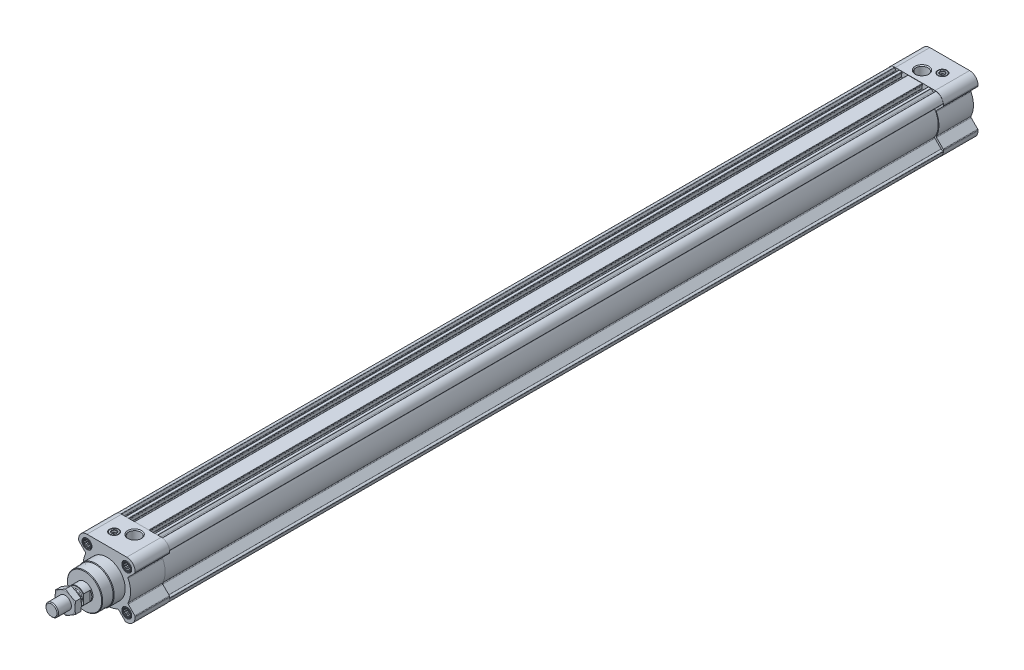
SolidWorks part; units mm, degrees
ref_plane "Plano frontal" through (0, 0, 0) normal (0, 0, 1) x (1, 0, 0)
ref_plane "Plano superior" through (0, 0, 0) normal (0, 1, 0) x (1, 0, 0)
ref_plane "Plano direito" through (0, 0, 0) normal (1, 0, 0) x (0, 0, -1)
imported_body "1"
imported_body "2"
imported_body "3"
sketch "Esboço1" plane through (0, 0, 0) normal (1, 0, 0) x (0, 0, -1)
  line L1 (166.8333, 56.6881) -> (181.9501, 56.6881)
  line L2 (166.8333, 56.6881) -> (166.8333, -68.5657)
  line L3 (166.8333, -68.5657) -> (181.9501, -68.5657)
  line L4 (181.9501, 56.6881) -> (181.9501, -68.5657)
extrude "Corte-extrusão1" cut sketch "Esboço1" against normal through all both and the other way through all
move or copy body "Corpo-Mover/Copiar1" bodies to move or copy 107 106 101 copy no translate (0, 0, 200)
sketch "Esboço2" plane through (0, 0, -181.9501) normal (0, 0, 1) x (1, 0, 0)
  circle A1 centre (0, 0) radius 8
  circle A2 centre (0, 0) radius 8
  dimension "D1" = 0
extrude "Ressalto-extrusão1" add sketch "Esboço2" along normal blind 326
sketch "Esboço3" plane through (0, 0, -181.9501) normal (0, 0, 1) x (1, 0, 0)
  line L35 (-18.9201, -12.6976) -> (-24.7051, -18.4826)
  line L36 (-24.788, -18.5462) -> (-26.5208, -19.5466)
  line L37 (-19.5419, -26.5212) -> (-18.5345, -24.7763)
  line L38 (-18.471, -24.6935) -> (-12.6976, -18.9201)
  line L39 (12.6976, -18.9201) -> (18.471, -24.6935)
  line L40 (18.5345, -24.7763) -> (19.5419, -26.5212)
  line L41 (26.5208, -19.5466) -> (24.788, -18.5462)
  line L42 (24.7051, -18.4826) -> (18.9201, -12.6976)
  line L43 (18.9201, 12.6976) -> (24.7051, 18.4826)
  line L44 (24.788, 18.5462) -> (26.5208, 19.5466)
  line L45 (19.5466, 26.5208) -> (18.582, 24.85)
  line L46 (18.2356, 24.65) -> (17.9713, 24.65)
  line L47 (16.9107, 25.0893) -> (15.3672, 26.6328)
  line L48 (15.0843, 26.75) -> (12.75, 26.75)
  line L49 (12.35, 26.35) -> (12.35, 25.45)
  line L50 (12.55, 25.25) -> (12.8, 25.25)
  line L51 (13, 25.05) -> (13, 22.45)
  line L52 (12.6, 22.05) -> (6.9, 22.05)
  line L53 (6.5, 22.45) -> (6.5, 25.05)
  line L54 (6.7, 25.25) -> (6.95, 25.25)
  line L55 (7.15, 25.45) -> (7.15, 26.35)
  line L56 (6.75, 26.75) -> (-6.75, 26.75)
  line L57 (-7.15, 26.35) -> (-7.15, 25.45)
  line L58 (-6.95, 25.25) -> (-6.7, 25.25)
  line L59 (-6.5, 25.05) -> (-6.5, 22.45)
  line L60 (-6.9, 22.05) -> (-12.6, 22.05)
  line L61 (-13, 22.45) -> (-13, 25.05)
  line L62 (-12.8, 25.25) -> (-12.55, 25.25)
  line L63 (-12.35, 25.45) -> (-12.35, 26.35)
  line L64 (-12.75, 26.75) -> (-15.0843, 26.75)
  line L65 (-15.3672, 26.6328) -> (-16.9107, 25.0893)
  line L66 (-17.9713, 24.65) -> (-18.2356, 24.65)
  line L67 (-18.582, 24.85) -> (-19.5466, 26.5208)
  line L68 (-26.5208, 19.5466) -> (-24.788, 18.5462)
  line L69 (-24.7051, 18.4826) -> (-18.9201, 12.6976)
  line L70 (-18.9201, -12.6976) -> (-24.7051, -18.4826)
  line L71 (-24.788, -18.5462) -> (-26.5208, -19.5466)
  line L72 (-19.5419, -26.5212) -> (-18.5345, -24.7763)
  line L73 (-18.471, -24.6935) -> (-12.6976, -18.9201)
  line L74 (12.6976, -18.9201) -> (18.471, -24.6935)
  line L75 (18.5345, -24.7763) -> (19.5419, -26.5212)
  line L76 (26.5208, -19.5466) -> (24.788, -18.5462)
  line L77 (24.7051, -18.4826) -> (18.9201, -12.6976)
  line L78 (18.9201, 12.6976) -> (24.7051, 18.4826)
  line L79 (24.788, 18.5462) -> (26.5208, 19.5466)
  line L80 (19.5466, 26.5208) -> (18.582, 24.85)
  line L81 (18.2356, 24.65) -> (17.9713, 24.65)
  line L82 (16.9107, 25.0893) -> (15.3672, 26.6328)
  line L83 (15.0843, 26.75) -> (12.75, 26.75)
  line L84 (12.35, 26.35) -> (12.35, 25.45)
  line L85 (12.55, 25.25) -> (12.8, 25.25)
  line L86 (13, 25.05) -> (13, 22.45)
  line L87 (12.6, 22.05) -> (6.9, 22.05)
  line L88 (6.5, 22.45) -> (6.5, 25.05)
  line L89 (6.7, 25.25) -> (6.95, 25.25)
  line L90 (7.15, 25.45) -> (7.15, 26.35)
  line L91 (6.75, 26.75) -> (-6.75, 26.75)
  line L92 (-7.15, 26.35) -> (-7.15, 25.45)
  line L93 (-6.95, 25.25) -> (-6.7, 25.25)
  line L94 (-6.5, 25.05) -> (-6.5, 22.45)
  line L95 (-6.9, 22.05) -> (-12.6, 22.05)
  line L96 (-13, 22.45) -> (-13, 25.05)
  line L97 (-12.8, 25.25) -> (-12.55, 25.25)
  line L98 (-12.35, 25.45) -> (-12.35, 26.35)
  line L99 (-12.75, 26.75) -> (-15.0843, 26.75)
  line L100 (-15.3672, 26.6328) -> (-16.9107, 25.0893)
  line L101 (-17.9713, 24.65) -> (-18.2356, 24.65)
  line L102 (-18.582, 24.85) -> (-19.5466, 26.5208)
  line L103 (-26.5208, 19.5466) -> (-24.788, 18.5462)
  line L104 (-24.7051, 18.4826) -> (-18.9201, 12.6976)
  circle A0 centre (0, 0) radius 20 construction
  circle A1 centre (0, 0) radius 20
  arc A49 (-24.788, -18.5462) -> (-24.7051, -18.4826) centre (-24.988, -18.1997) ccw
  arc A50 (-26.5208, -19.5466) -> (-26.7192, -19.9293) centre (-26.3208, -19.893) ccw
  arc A51 (-26.7192, -19.9293) -> (-19.9243, -26.7196) centre (-19.25, -19.25) ccw
  arc A52 (-19.9243, -26.7196) -> (-19.5419, -26.5212) centre (-19.8884, -26.3212) ccw
  arc A53 (-18.471, -24.6935) -> (-18.5345, -24.7763) centre (-18.1881, -24.9763) ccw
  arc A54 (-11.4692, -18.7739) -> (-12.6976, -18.9201) centre (-11.9905, -19.6272) ccw
  arc A55 (-11.4692, -18.7739) -> (11.4692, -18.7739) centre (0, 0) ccw
  arc A56 (12.6976, -18.9201) -> (11.4692, -18.7739) centre (11.9905, -19.6272) ccw
  arc A57 (18.5345, -24.7763) -> (18.471, -24.6935) centre (18.1881, -24.9763) ccw
  arc A58 (19.5419, -26.5212) -> (19.9243, -26.7196) centre (19.8884, -26.3212) ccw
  arc A59 (19.9243, -26.7196) -> (26.7192, -19.9293) centre (19.25, -19.25) ccw
  arc A60 (26.7192, -19.9293) -> (26.5208, -19.5466) centre (26.3208, -19.893) ccw
  arc A61 (24.7051, -18.4826) -> (24.788, -18.5462) centre (24.988, -18.1997) ccw
  arc A62 (18.7739, -11.4692) -> (18.9201, -12.6976) centre (19.6272, -11.9905) ccw
  arc A63 (18.7739, -11.4692) -> (18.7739, 11.4692) centre (0, 0) ccw
  arc A64 (18.9201, 12.6976) -> (18.7739, 11.4692) centre (19.6272, 11.9905) ccw
  arc A65 (24.788, 18.5462) -> (24.7051, 18.4826) centre (24.988, 18.1997) ccw
  arc A66 (26.5208, 19.5466) -> (26.7192, 19.9293) centre (26.3208, 19.893) ccw
  arc A67 (26.7192, 19.9293) -> (19.9293, 26.7192) centre (19.25, 19.25) ccw
  arc A68 (19.9293, 26.7192) -> (19.5466, 26.5208) centre (19.893, 26.3208) ccw
  arc A69 (18.2356, 24.65) -> (18.582, 24.85) centre (18.2356, 25.05) ccw
  arc A70 (16.9107, 25.0893) -> (17.9713, 24.65) centre (17.9713, 26.15) ccw
  arc A71 (15.3672, 26.6328) -> (15.0843, 26.75) centre (15.0843, 26.35) ccw
  arc A72 (12.75, 26.75) -> (12.35, 26.35) centre (12.75, 26.35) ccw
  arc A73 (12.35, 25.45) -> (12.55, 25.25) centre (12.55, 25.45) ccw
  arc A74 (13, 25.05) -> (12.8, 25.25) centre (12.8, 25.05) ccw
  arc A75 (12.6, 22.05) -> (13, 22.45) centre (12.6, 22.45) ccw
  arc A76 (6.5, 22.45) -> (6.9, 22.05) centre (6.9, 22.45) ccw
  arc A77 (6.7, 25.25) -> (6.5, 25.05) centre (6.7, 25.05) ccw
  arc A78 (6.95, 25.25) -> (7.15, 25.45) centre (6.95, 25.45) ccw
  arc A79 (7.15, 26.35) -> (6.75, 26.75) centre (6.75, 26.35) ccw
  arc A80 (-6.75, 26.75) -> (-7.15, 26.35) centre (-6.75, 26.35) ccw
  arc A81 (-7.15, 25.45) -> (-6.95, 25.25) centre (-6.95, 25.45) ccw
  arc A82 (-6.5, 25.05) -> (-6.7, 25.25) centre (-6.7, 25.05) ccw
  arc A83 (-6.9, 22.05) -> (-6.5, 22.45) centre (-6.9, 22.45) ccw
  arc A84 (-13, 22.45) -> (-12.6, 22.05) centre (-12.6, 22.45) ccw
  arc A85 (-12.8, 25.25) -> (-13, 25.05) centre (-12.8, 25.05) ccw
  arc A86 (-12.55, 25.25) -> (-12.35, 25.45) centre (-12.55, 25.45) ccw
  arc A87 (-12.35, 26.35) -> (-12.75, 26.75) centre (-12.75, 26.35) ccw
  arc A88 (-15.0843, 26.75) -> (-15.3672, 26.6328) centre (-15.0843, 26.35) ccw
  arc A89 (-17.9713, 24.65) -> (-16.9107, 25.0893) centre (-17.9713, 26.15) ccw
  arc A90 (-18.582, 24.85) -> (-18.2356, 24.65) centre (-18.2356, 25.05) ccw
  arc A91 (-19.5466, 26.5208) -> (-19.9293, 26.7192) centre (-19.893, 26.3208) ccw
  arc A92 (-19.9293, 26.7192) -> (-26.7192, 19.9293) centre (-19.25, 19.25) ccw
  arc A93 (-26.7192, 19.9293) -> (-26.5208, 19.5466) centre (-26.3208, 19.893) ccw
  arc A94 (-24.7051, 18.4826) -> (-24.788, 18.5462) centre (-24.988, 18.1997) ccw
  arc A95 (-18.7739, 11.4692) -> (-18.9201, 12.6976) centre (-19.6272, 11.9905) ccw
  arc A96 (-18.7739, 11.4692) -> (-18.7739, -11.4692) centre (0, 0) ccw
  arc A97 (-18.9201, -12.6976) -> (-18.7739, -11.4692) centre (-19.6272, -11.9905) ccw
  arc A98 (-24.788, -18.5462) -> (-24.7051, -18.4826) centre (-24.988, -18.1997) ccw
  arc A99 (-26.5208, -19.5466) -> (-26.7192, -19.9293) centre (-26.3208, -19.893) ccw
  arc A100 (-26.7192, -19.9293) -> (-19.9243, -26.7196) centre (-19.25, -19.25) ccw
  arc A101 (-19.9243, -26.7196) -> (-19.5419, -26.5212) centre (-19.8884, -26.3212) ccw
  arc A102 (-18.471, -24.6935) -> (-18.5345, -24.7763) centre (-18.1881, -24.9763) ccw
  arc A103 (-11.4692, -18.7739) -> (-12.6976, -18.9201) centre (-11.9905, -19.6272) ccw
  arc A104 (-11.4692, -18.7739) -> (11.4692, -18.7739) centre (0, 0) ccw
  arc A105 (12.6976, -18.9201) -> (11.4692, -18.7739) centre (11.9905, -19.6272) ccw
  arc A106 (18.5345, -24.7763) -> (18.471, -24.6935) centre (18.1881, -24.9763) ccw
  arc A107 (19.5419, -26.5212) -> (19.9243, -26.7196) centre (19.8884, -26.3212) ccw
  arc A108 (19.9243, -26.7196) -> (26.7192, -19.9293) centre (19.25, -19.25) ccw
  arc A109 (26.7192, -19.9293) -> (26.5208, -19.5466) centre (26.3208, -19.893) ccw
  arc A110 (24.7051, -18.4826) -> (24.788, -18.5462) centre (24.988, -18.1997) ccw
  arc A111 (18.7739, -11.4692) -> (18.9201, -12.6976) centre (19.6272, -11.9905) ccw
  arc A112 (18.7739, -11.4692) -> (18.7739, 11.4692) centre (0, 0) ccw
  arc A113 (18.9201, 12.6976) -> (18.7739, 11.4692) centre (19.6272, 11.9905) ccw
  arc A114 (24.788, 18.5462) -> (24.7051, 18.4826) centre (24.988, 18.1997) ccw
  arc A115 (26.5208, 19.5466) -> (26.7192, 19.9293) centre (26.3208, 19.893) ccw
  arc A116 (26.7192, 19.9293) -> (19.9293, 26.7192) centre (19.25, 19.25) ccw
  arc A117 (19.9293, 26.7192) -> (19.5466, 26.5208) centre (19.893, 26.3208) ccw
  arc A118 (18.2356, 24.65) -> (18.582, 24.85) centre (18.2356, 25.05) ccw
  arc A119 (16.9107, 25.0893) -> (17.9713, 24.65) centre (17.9713, 26.15) ccw
  arc A120 (15.3672, 26.6328) -> (15.0843, 26.75) centre (15.0843, 26.35) ccw
  arc A121 (12.75, 26.75) -> (12.35, 26.35) centre (12.75, 26.35) ccw
  arc A122 (12.35, 25.45) -> (12.55, 25.25) centre (12.55, 25.45) ccw
  arc A123 (13, 25.05) -> (12.8, 25.25) centre (12.8, 25.05) ccw
  arc A124 (12.6, 22.05) -> (13, 22.45) centre (12.6, 22.45) ccw
  arc A125 (6.5, 22.45) -> (6.9, 22.05) centre (6.9, 22.45) ccw
  arc A126 (6.7, 25.25) -> (6.5, 25.05) centre (6.7, 25.05) ccw
  arc A127 (6.95, 25.25) -> (7.15, 25.45) centre (6.95, 25.45) ccw
  arc A128 (7.15, 26.35) -> (6.75, 26.75) centre (6.75, 26.35) ccw
  arc A129 (-6.75, 26.75) -> (-7.15, 26.35) centre (-6.75, 26.35) ccw
  arc A130 (-7.15, 25.45) -> (-6.95, 25.25) centre (-6.95, 25.45) ccw
  arc A131 (-6.5, 25.05) -> (-6.7, 25.25) centre (-6.7, 25.05) ccw
  arc A132 (-6.9, 22.05) -> (-6.5, 22.45) centre (-6.9, 22.45) ccw
  arc A133 (-13, 22.45) -> (-12.6, 22.05) centre (-12.6, 22.45) ccw
  arc A134 (-12.8, 25.25) -> (-13, 25.05) centre (-12.8, 25.05) ccw
  arc A135 (-12.55, 25.25) -> (-12.35, 25.45) centre (-12.55, 25.45) ccw
  arc A136 (-12.35, 26.35) -> (-12.75, 26.75) centre (-12.75, 26.35) ccw
  arc A137 (-15.0843, 26.75) -> (-15.3672, 26.6328) centre (-15.0843, 26.35) ccw
  arc A138 (-17.9713, 24.65) -> (-16.9107, 25.0893) centre (-17.9713, 26.15) ccw
  arc A139 (-18.582, 24.85) -> (-18.2356, 24.65) centre (-18.2356, 25.05) ccw
  arc A140 (-19.5466, 26.5208) -> (-19.9293, 26.7192) centre (-19.893, 26.3208) ccw
  arc A141 (-19.9293, 26.7192) -> (-26.7192, 19.9293) centre (-19.25, 19.25) ccw
  arc A142 (-26.7192, 19.9293) -> (-26.5208, 19.5466) centre (-26.3208, 19.893) ccw
  arc A143 (-24.7051, 18.4826) -> (-24.788, 18.5462) centre (-24.988, 18.1997) ccw
  arc A144 (-18.7739, 11.4692) -> (-18.9201, 12.6976) centre (-19.6272, 11.9905) ccw
  arc A145 (-18.7739, 11.4692) -> (-18.7739, -11.4692) centre (0, 0) ccw
  arc A146 (-18.9201, -12.6976) -> (-18.7739, -11.4692) centre (-19.6272, -11.9905) ccw
  dimension "D1" = 0
extrude "Ressalto-extrusão2" add sketch "Esboço3" along normal blind 326
